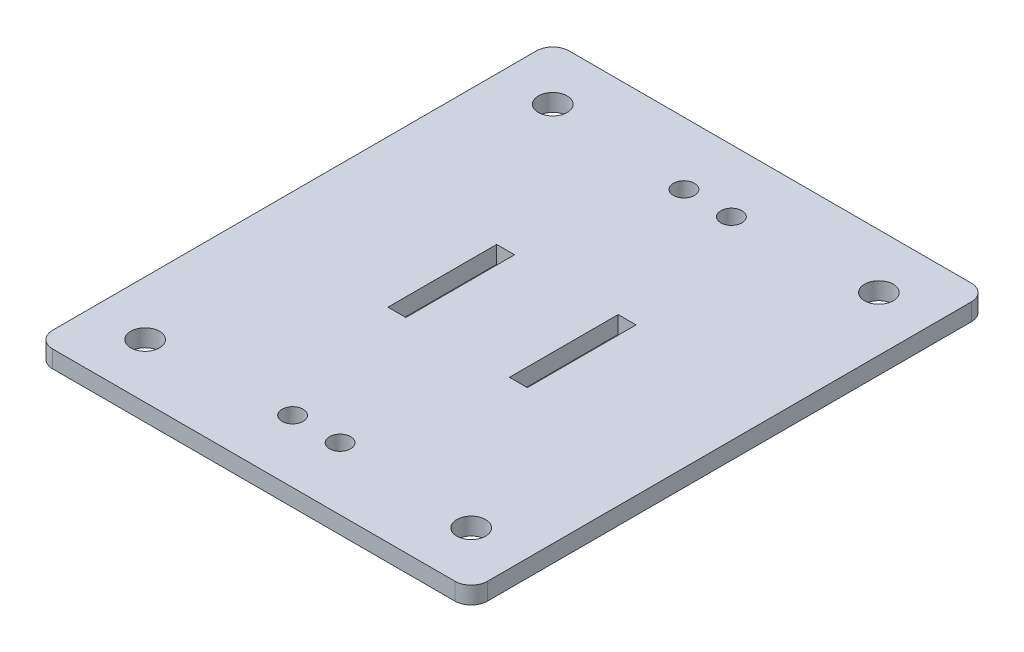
SolidWorks part; units mm, degrees
ref_plane "Front Plane" through (0, 0, 0) normal (0, 0, 1) x (1, 0, 0)
ref_plane "Top Plane" through (0, 0, 0) normal (0, 1, 0) x (1, 0, 0)
ref_plane "Right Plane" through (0, 0, 0) normal (1, 0, 0) x (0, 0, -1)
sketch "Sketch1" plane through (0, 0, 0) normal (0, 1, 0) x (1, 0, 0)
  line L0 (40, 95) -> (40, 0) construction
  line L1 (0, 0) -> (80, 0)
  line L2 (0, 0) -> (0, 95)
  line L3 (0, 95) -> (80, 95)
  line L4 (80, 0) -> (80, 95)
  line L5 (80, 47.5) -> (0, 47.5) construction
  line L6 (30.475, 37.5) -> (30.475, 57.5)
  line L7 (49.525, 37.5) -> (52.825, 37.5)
  line L8 (49.525, 37.5) -> (49.525, 57.5)
  line L9 (49.525, 57.5) -> (52.825, 57.5)
  line L10 (52.825, 37.5) -> (52.825, 57.5)
  line L11 (49.525, 37.5) -> (52.825, 57.5) construction
  line L12 (49.525, 57.5) -> (52.825, 37.5) construction
  line L13 (30.475, 57.5) -> (27.175, 57.5)
  line L14 (27.175, 37.5) -> (27.175, 57.5)
  line L15 (30.475, 37.5) -> (27.175, 37.5)
  circle A0 centre (44.3688, 83.5) radius 1.9431
  circle A1 centre (35.6312, 83.5) radius 1.9431
  circle A2 centre (44.3688, 11.5) radius 1.9431
  circle A3 centre (35.6312, 11.5) radius 1.9431
  circle A4 centre (70, 10) radius 2.65
  circle A5 centre (10, 10) radius 2.65
  circle A6 centre (70, 85) radius 2.65
  circle A7 centre (10, 85) radius 2.65
  point P9 (51.175, 47.5)
extrude "Boss-Extrude1" add sketch "Sketch1" along normal blind 3.175
fillet "Fillet1" radius 3 4 edges at (0, 1.5875, -95) (80, 1.5875, -95) (0, 1.5875, 0) (80, 1.5875, 0)
other "Move Face1" [suppressed] parameters "D1"=0.0762
equation "\"D12@Sketch1\"=\"D9@Sketch1\""
equation "\"D13@Sketch1\"=\"D10@Sketch1\""
equation "\"D14@Sketch1\"=\"D10@Sketch1\""
equation "\"D15@Sketch1\"=\"D9@Sketch1\""
equation "\"D16@Sketch1\"=\"D9@Sketch1\""
equation "\"D17@Sketch1\"=\"D10@Sketch1\""
